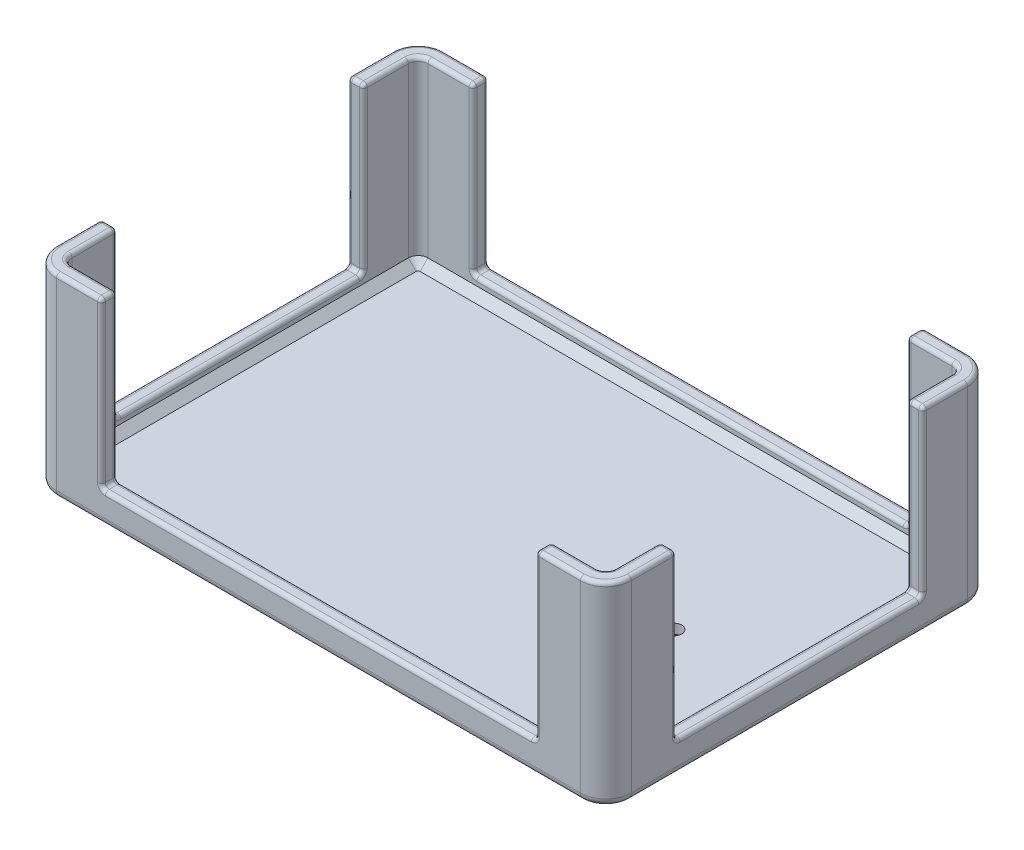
SolidWorks part; units mm, degrees
ref_plane "Piano frontale" through (0, 0, 0) normal (0, 0, 1) x (1, 0, 0)
ref_plane "Piano superiore" through (0, 0, 0) normal (0, 1, 0) x (1, 0, 0)
ref_plane "Piano destro" through (0, 0, 0) normal (1, 0, 0) x (0, 0, -1)
sketch "Schizzo1" plane through (0, 0, 0) normal (0, 1, 0) x (1, 0, 0)
  line L1 (6.5, 0) -> (140.5, 0)
  line L2 (0, 6.5) -> (0, 92.5)
  line L3 (6.5, 99) -> (140.5, 99)
  line L4 (147, 6.5) -> (147, 92.5)
  arc A0 (0, 6.5) -> (6.5, 0) centre (6.5, 6.5) ccw
  arc A1 (140.5, 0) -> (147, 6.5) centre (140.5, 6.5) ccw
  arc A2 (147, 92.5) -> (140.5, 99) centre (140.5, 92.5) ccw
  arc A3 (0, 92.5) -> (6.5, 99) centre (6.5, 92.5) cw
  point P7 (0, 0)
  point P10 (147, 0)
  point P13 (147, 99)
  point P16 (0, 99)
  dimension "D3" = 6.5
  dimension "D1" = 147
  dimension "D2" = 99
extrude "Estrusione-Estrusione1" add sketch "Schizzo1" along normal blind 50
shell "Svuota1" thickness 4
sketch "Schizzo2" plane through (0, 0, 0) normal (-1, 0, 0) x (0, 0, 1)
  line L0 (-92.5, 50) -> (-6.5, 50) construction
  line L1 (-81, 50) -> (-18, 50)
  line L2 (-81, 50) -> (-81, 8)
  line L3 (-81, 8) -> (-18, 8)
  line L4 (-18, 50) -> (-18, 8)
  line L5 (-92.5, 0) -> (-6.5, 0) construction
  line L6 (-49.5, 0) -> (-49.5, 50) construction
  point P8 (-49.5, 0)
  point P11 (-49.5, 8)
  dimension "D1" = 63
  dimension "D2" = 8
extrude "Taglio-Estrusione1" cut sketch "Schizzo2" against normal through all
sketch "Schizzo3" plane through (0, 0, 0) normal (0, 0, 1) x (1, 0, 0)
  line L0 (6.5, 50) -> (140.5, 50) construction
  line L1 (18, 50) -> (129, 50)
  line L2 (18, 50) -> (18, 8)
  line L3 (18, 8) -> (129, 8)
  line L4 (129, 50) -> (129, 8)
  line L5 (73.5, 0) -> (73.5, 50) construction
  line L7 (73.5, 8) -> (73.5, 50) construction
  line L8 (6.5, 0) -> (140.5, 0) construction
  dimension "D1" = 8
  dimension "D2" = 111
extrude "Taglio-Estrusione2" cut sketch "Schizzo3" against normal through all
chamfer "Smusso1" distance 2 angle 45 8 edges at (4, 4, -49.5) (4.7322, 4, -4.7322) (73.5, 4, -4) (4.7322, 4, -94.2678) (73.5, 4, -95) (142.2678, 4, -94.2678) (143, 4, -49.5) (142.2678, 4, -4.7322)
fillet "Raccordo1" radius 1 64 edges at (18, 29, -99) (18, 29, -95) (12.25, 50, 0) (1.9038, 50, -1.9038) (0, 50, -12.25) (2, 50, -18) (4, 50, -12.25) (4.7322, 50, -4.7322) (12.25, 50, -4) (18, 50, -2) (129, 29, 0) (129, 29, -4) (2, 8, -18) (0, 8, -49.5) (2, 8, -81) (4, 8, -49.5) (129, 8, -2) (73.5, 8, 0) (18, 8, -2) (73.5, 8, -4) (134.75, 50, -4) (142.2678, 50, -4.7322) (143, 50, -12.25) (147, 50, -12.25) (145.0962, 50, -1.9038) (134.75, 50, 0) (129, 50, -2) (147, 8, -49.5) (143, 8, -49.5) (18, 8, -97) (73.5, 8, -99) (73.5, 8, -95) (129, 8, -97) (129, 29, -99) (129, 29, -95) (134.75, 50, -99) (145.0962, 50, -97.0962) (147, 50, -86.75) (143, 50, -86.75) (142.2678, 50, -94.2678) (134.75, 50, -95) (129, 50, -97) (145, 50, -81) (147, 29, -81) (145, 8, -81) (143, 29, -81) (145, 8, -18) (147, 29, -18) (145, 50, -18) (143, 29, -18) (12.25, 50, -95) (4.7322, 50, -94.2678) (4, 50, -86.75) (2, 50, -81) (0, 50, -86.75) (1.9038, 50, -97.0962) (12.25, 50, -99) (18, 50, -97) (4, 29, -81) (0, 29, -81) (0, 29, -18) (4, 29, -18) (18, 29, -4) (18, 29, 0)
fillet "Raccordo2" radius 2 8 edges at (73.5, 0, 0) (145.0962, 0, -1.9038) (147, 0, -49.5) (145.0962, 0, -97.0962) (73.5, 0, -99) (1.9038, 0, -97.0962) (0, 0, -49.5) (1.9038, 0, -1.9038)
sketch "Schizzo4" plane through (0, 4, 0) normal (0, 1, 0) x (1, 0, 0)
  line L0 (141, 49.5) -> (6, 49.5) construction
  line L1 (141, 6.5) -> (141, 92.5) construction
  line L2 (6, 92.5) -> (6, 6.5) construction
  line L3 (73.5, 93) -> (73.5, 6) construction
  line L4 (140.5, 93) -> (6.5, 93) construction
  line L5 (6.5, 6) -> (140.5, 6) construction
  circle A6 centre (118.25, 46.15) radius 2
  point P18 (27.75, 49.5)
  point P25 (111.93, 71.68)
  point P37 (73.5, 87.85)
  point P38 (73.5, 11.15)
  point P39 (41.56, 49.5)
  point P40 (105.44, 49.5)
  dimension "D24" = 4
  dimension "D25" = 3.35
  dimension "D26" = 44.75
extrude "Taglio-Estrusione3" cut sketch "Schizzo4" against normal through all contours A6
chamfer "Smusso3" distance 1.5 angle 45 1 edges at (118.25, 0, -44.15)
